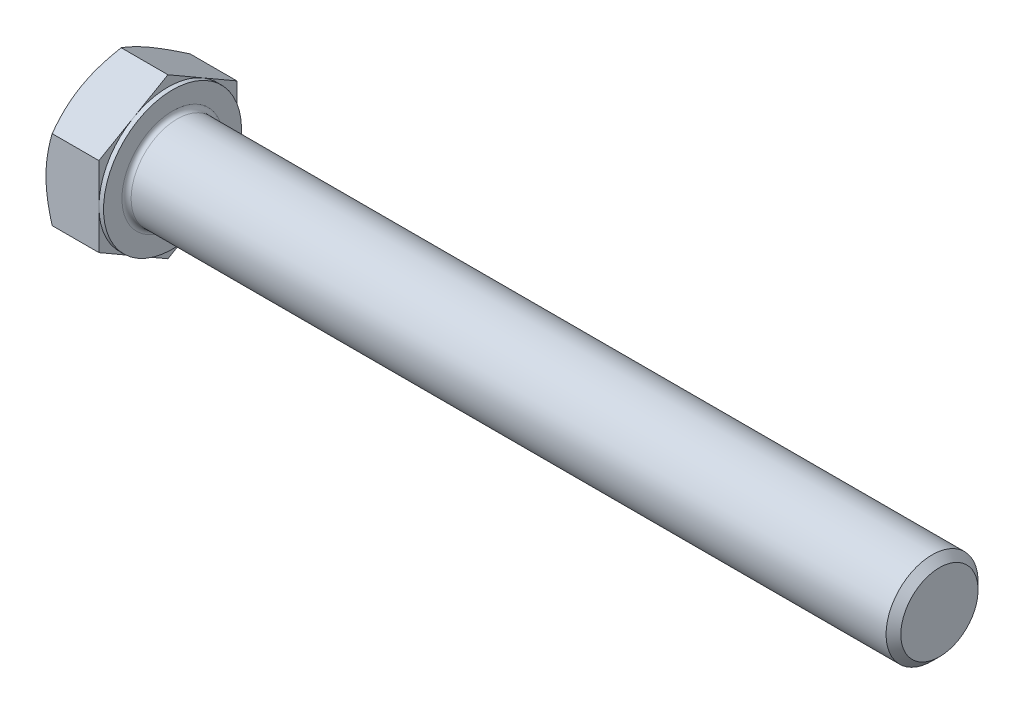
SolidWorks part; units mm, degrees
extrude "BaseHead" add sketch "Sketch1" along normal blind 7.5
sketch "Sketch1" plane through (0, 0, 0) normal (1, 0, 0) x (0, 0, -1)
  line L0 (9, 5.1962) -> (9, -5.1962)
  line L1 (-9, 5.1962) -> (-9, -5.1962)
  line L2 (9, -5.1962) -> (0, -10.3923)
  line L3 (0, -10.3923) -> (-9, -5.1962)
  line L4 (9, 5.1962) -> (0, 10.3923)
  line L5 (0, 10.3923) -> (-9, 5.1962)
revolve "HeadChamfer" cut sketch "Sketch3" angle 360 about L6
sketch "Sketch3" plane through (0, 0, 0) normal (0, 0, 1) x (1, 0, 0)
  line L0 (0, 9) -> (3.6906, 15.3923)
  line L1 (0, 10.3923) -> (0, 5.1962) construction
  line L2 (3.6906, 15.3923) -> (3.6906, 20.3923)
  line L3 (3.6906, 20.3923) -> (-10, 20.3923)
  line L4 (-10, 20.3923) -> (-10, 9)
  line L5 (-10, 9) -> (0, 9)
  line L6 (0, 0) -> (99.06, 0) construction
  line L7 (7.5, 10.3923) -> (0, 10.3923) construction
ref_plane "Plane1" through (0, 0, 0) normal (0, 0, 1) x (1, 0, 0)
ref_plane "Plane2" through (0, 0, 0) normal (0, 1, 0) x (1, 0, 0)
ref_plane "Plane3" through (0, 0, 0) normal (1, 0, 0) x (0, 0, -1)
sketch "BodySke" plane through (0, 0, 0) normal (0, 0, 1) x (1, 0, 0)
  line L0 (0, 5.1962) -> (0, -5.1962) construction
  line L1 (0, 0) -> (107.5, 0)
  line L2 (0, 0) -> (0, 6)
  line L3 (0, 6) -> (106.536, 6)
  line L4 (107.5, 0) -> (107.5, 5.036)
  line L5 (7.5, 10.3923) -> (7.5, 5.1962) construction
  line L6 (107.5, 5.036) -> (106.536, 6)
  line L7 (0, 0) -> (96.52, 0) construction
  line L8 (107.5, -5.036) -> (106.536, -6) construction
  line L9 (0, -6) -> (106.536, -6) construction
  line L10 (9.25, 15.24) -> (9.25, -1.27) construction
  line L11 (77.5, 15.24) -> (77.5, -1.27) construction
  line L12 (7.5, 5.1962) -> (7.5, -5.1962) construction
revolve "BaseBody" add sketch "BodySke"
fillet "HeadFillet" radius 0.6 1 edges at (7.5, 0, -6)
sketch "Sketch4" plane through (0, 0, 0) normal (0, 0, 1) x (1, 0, 0)
  line L1 (7.5, 10.3923) -> (7.5, 5.1962) construction
  line L2 (7.5, 9) -> (6.9, 9)
  line L3 (7.5, 9) -> (7.5, 20.3923)
  line L4 (7.5, 20.3923) -> (6.9, 20.3923)
  line L5 (0, 0) -> (95.25, 0) construction
  line L6 (0, 0) -> (96.52, 0) construction
  line L7 (6.9, 9) -> (6.9, 20.3923)
  line L8 (7.5, 10.3923) -> (0.8038, 10.3923) construction
revolve "BearingFace" cut sketch "Sketch4" angle 360 about L5
sketch "ThdSchSke" plane through (0, 0, 0) normal (0, 0, 1) x (1, 0, 0)
  line L0 (77.5, -5.036) -> (76.825, -6)
  line L1 (77.5, -5.036) -> (78.175, -6)
  line L2 (78.175, -6) -> (78.175, -7.5)
  line L3 (-3.175, 0) -> (5.1513, 0) construction
  line L5 (78.175, -7.5) -> (76.825, -7.5)
  line L6 (76.825, -7.5) -> (76.825, -6)
revolve "ThreadSchematic" [suppressed] cut sketch "ThdSchSke" angle 360 about L3
pattern_linear "ThdSchPat" [suppressed]
equation "\"D3@Sketch1\" = \"Width_flats@Sketch1\" / 2"
equation "\"D4@Sketch1\" = \"D3@Sketch1\""
equation "\"D5@Sketch1\" = \"D4@Sketch1\""
equation "\"Thread_minor@ThreadCosmetic\" = \"Minor_dia@BodySke\""
equation "\"D1@Sketch3\" = \"Width_flats@Sketch1\" / 2"
equation "\"D1@Sketch4\" = \"Width_flats@Sketch1\""
equation "\"Thread_length@ThreadCosmetic\" = ((sgn( (\"Length@BodySke\" - \"Advance@BodySke\" ) - \"Thread_nom@BodySke\" )-1)*( (\"Length@BodySke\" - \"Advance@BodySke\" ) - \"Thread_nom@BodySke\" ))/-2+ \"Thread_nom@BodySke\""
equation "\"Thread_minor@ThdSchSke\" = \"Minor_dia@BodySke\""
equation "\"Diameter@ThdSchSke\" = \"Diameter@BodySke\""
equation "\"Overcut@ThdSchSke\" = \"Diameter@BodySke\" * 1.25"
equation "\"Start@ThdSchSke\" = \"Head_ht@BaseHead\" + \"Length@BodySke\" - \"Thread_length@ThreadCosmetic\"  '---Non-countersunk---"
equation "\"Num_threads@ThdSchPat\" = int( \"Thread_length@ThreadCosmetic\" / \"Advance@BodySke\" + 0.999 )  + 1"
equation "\"Advance@ThdSchPat\" = \"Thread_length@ThreadCosmetic\" /  (\"Num_threads@ThdSchPat\" - 1) 'relax it"
equation "\"Num_threads@ThdSchPat\" = \"Num_threads@ThdSchPat\" - sgn( \"Num_threads@ThdSchPat\" - 1) '---chamfered tips only---"
